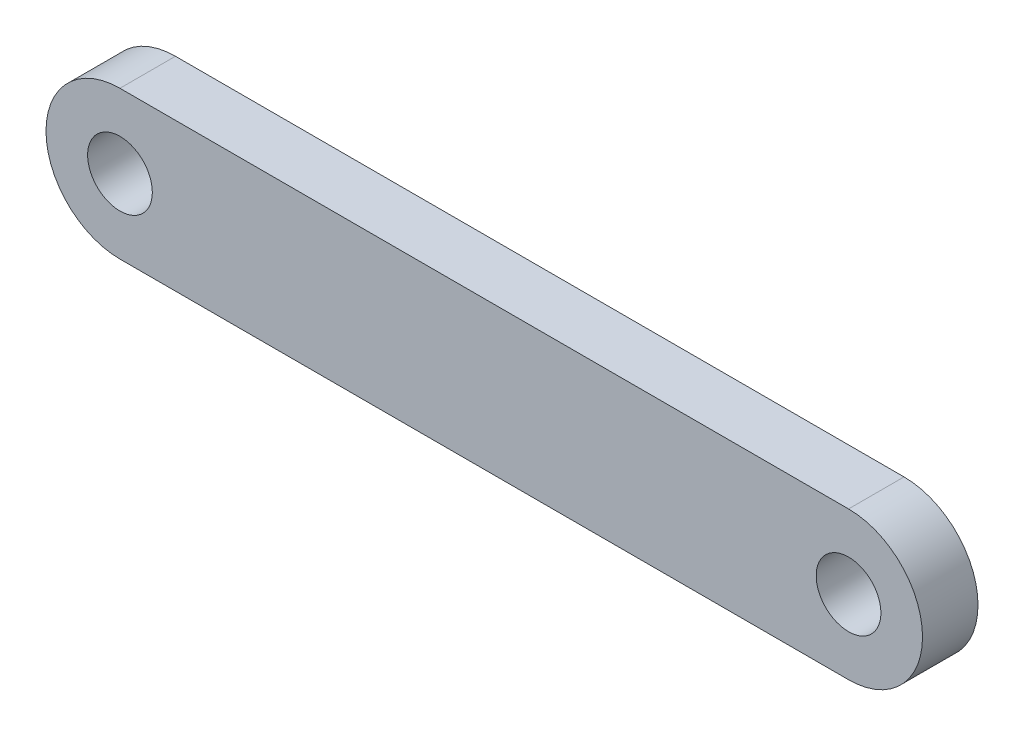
SolidWorks part; units mm, degrees
ref_plane "Plan de face" through (0, 0, 0) normal (0, 0, 1) x (1, 0, 0)
ref_plane "Plan de dessus" through (0, 0, 0) normal (0, 1, 0) x (1, 0, 0)
ref_plane "Plan de droite" through (0, 0, 0) normal (1, 0, 0) x (0, 0, -1)
sketch "Esquisse1" plane through (0, 0, 0) normal (0, 0, 1) x (1, 0, 0)
  line L0 (0, 0) -> (-39.4, 0)
  line L1 (-39.4, 4) -> (0, 4)
  line L2 (-39.4, -4) -> (0, -4)
  circle A0 centre (0, 0) radius 1.75
  circle A1 centre (-39.4, 0) radius 1.75
  arc A2 (0, -4) -> (0, 4) centre (0, 0) ccw
  arc A3 (-39.4, 4) -> (-39.4, -4) centre (-39.4, 0) ccw
  dimension "D1" = 3.5
  dimension "D2" = 3.5
  dimension "D4" = 8
  dimension "D5" = 8
  dimension "D3" = 39.4
  dimension "D6" = 39.4
  dimension "D7" = 39.4
extrude "Boss.-Extru.1" add sketch "Esquisse1" along normal blind 3
